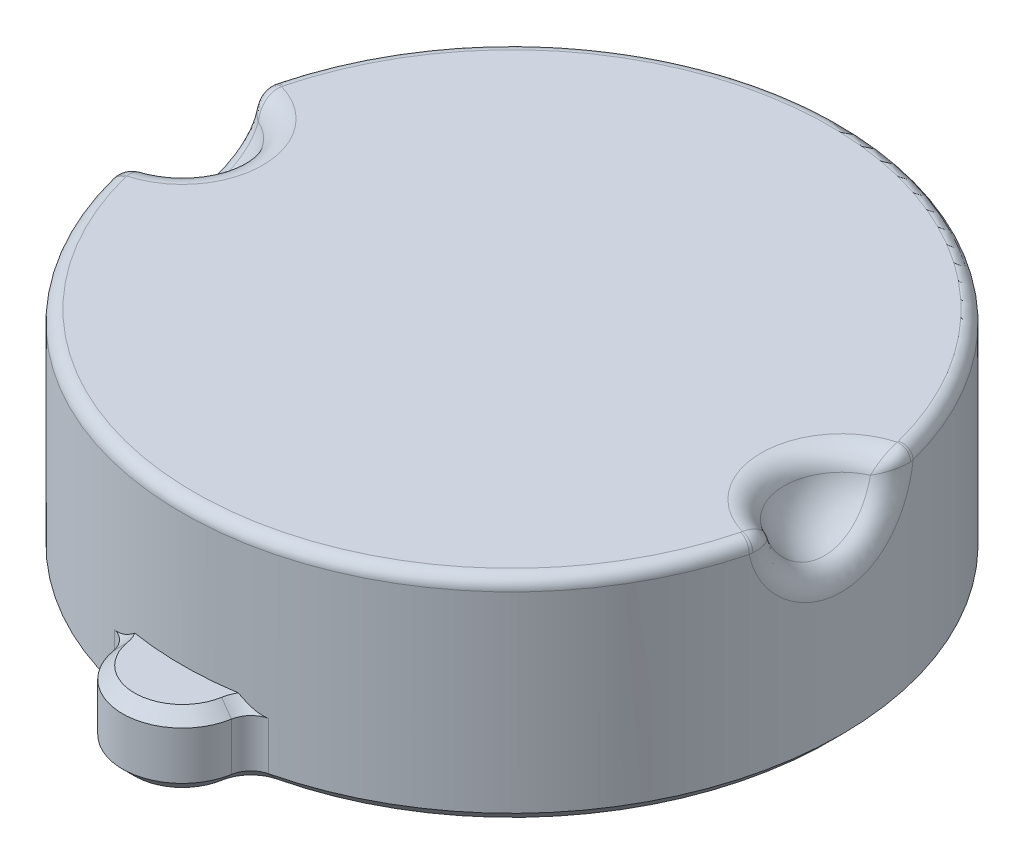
SolidWorks part; units mm, degrees
ref_plane "Alzado" through (0, 0, 0) normal (0, 0, 1) x (1, 0, 0)
ref_plane "Planta" through (0, 0, 0) normal (0, 1, 0) x (1, 0, 0)
ref_plane "Vista lateral" through (0, 0, 0) normal (1, 0, 0) x (0, 0, -1)
sketch "Croquis1" plane through (0, 0, 0) normal (0, 1, 0) x (1, 0, 0)
  circle A0 centre (0, 0) radius 27.5
  dimension "D1" = 55
extrude "Saliente-Extruir1" add sketch "Croquis1" along normal blind 18
shell "Vaciado1" thickness 10
sketch "Croquis2" plane through (0, 0, 0) normal (0, -1, 0) x (1, 0, 0)
  line L0 (0, 27.5) -> (0, -27.5) construction
  circle A0 centre (0, 27.5) radius 5
  circle A1 centre (0, 0) radius 27.5 construction
  circle A2 centre (0, -27.5) radius 5
  dimension "D1" = 10
  dimension "D2" = 10
extrude "Saliente-Extruir2" add sketch "Croquis2" against normal blind 6
fillet "Redondeo1" radius 2 4 edges at (4.9793, 3, -27.0455) (-4.9793, 3, -27.0455) (-4.9793, 3, 27.0455) (4.9793, 3, 27.0455)
chamfer "Chaflán1" distance 1 angle 45 14 edges at (-27.5, 0, 0) (-5.4391, 0, 27.3153) (-5.4391, 6, 27.3153) (-5.4391, 6, -27.3153) (-5.4391, 0, -27.3153) (0, 0, 32.5) (0, 0, -32.5) (5.4391, 6, 27.3153) (5.4391, 0, 27.3153) (5.4391, 0, -27.3153) (5.4391, 6, -27.3153) (27.5, 0, 0) (0, 6, -32.5) (0, 6, 32.5)
sketch "Croquis3" plane through (0, 18, 0) normal (0, 1, 0) x (1, 0, 0)
  line L0 (-27.5, 0) -> (0, 0) construction
  line L1 (0, 0) -> (27.5, 0) construction
  line L3 (32.5, 0) -> (22.5, 0)
  circle A1 centre (0, 0) radius 27.5 construction
  arc A2 (32.5, 0) -> (22.5, 0) centre (27.5, 0) ccw
  dimension "D1" = 10
revolve "Cortar-Revolución3" cut sketch "Croquis3" angle 360 about L3
fillet "Redondeo2" radius 2 2 edges at (27.4946, 13.0301, 0.5474) (22.5, 18, 0)
mirror "Simetría1" about plane through (0, 0, 0) normal (1, 0, 0) of "Cortar-Revolución3", "Redondeo2"
fillet "Redondeo3" radius 1 10 edges at (26.5273, 17.7333, -5.627) (26.5273, 17.7333, 5.627) (26.6461, 18, 6.784) (26.6461, 18, -6.784) (-26.5273, 17.7333, 5.627) (-26.5273, 17.7333, -5.627) (-26.6461, 18, -6.784) (-26.6461, 18, 6.784) (0, 18, -27.5) (0, 18, 27.5)
